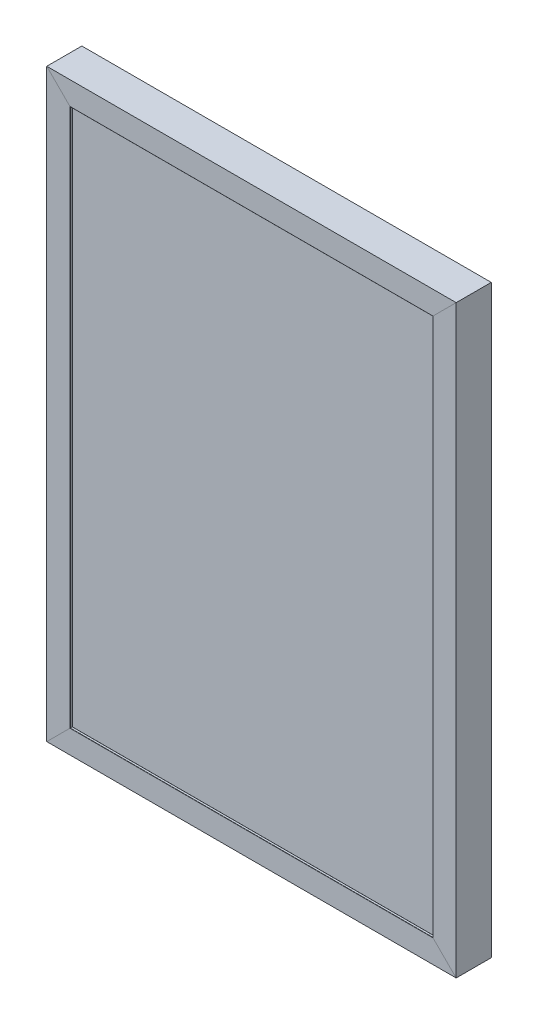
SolidWorks part; units mm, degrees
ref_plane "Vorne" through (0, 0, 0) normal (0, 0, 1) x (1, 0, 0)
ref_plane "Oben" through (0, 0, 0) normal (0, 1, 0) x (1, 0, 0)
ref_plane "Rechts" through (0, 0, 0) normal (1, 0, 0) x (0, 0, -1)
sketch "Skizze1" plane through (0, 0, 0) normal (0, 0, 1) x (1, 0, 0)
  line L0 (350, 500) -> (-350, -500) construction
  line L1 (-350, 500) -> (350, 500)
  line L2 (-350, 500) -> (-350, -500)
  line L3 (-350, -500) -> (350, -500)
  line L4 (350, 500) -> (350, -500)
  dimension "D1" = 700
  dimension "D2" = 1000
other "Strukturbauteil1"
ref_plane "Ebene1" through (-350, 500, 0) normal (0, -1, 0) x (0, 0, 1)
sketch "Sketch13" plane through (-350, 500, 0) normal (0, -1, 0) x (0, 0, -1)
  line L0 (0, 0) -> (0, 70) construction
  line L1 (-30, 0) -> (30, 0)
  line L2 (30, 0) -> (30, 39.6)
  line L3 (29.6, 40) -> (26.4, 40)
  line L4 (26, 39.6) -> (26, 6.5)
  line L5 (23.5, 4) -> (-23.5, 4)
  line L6 (-26, 39.6) -> (-26, 6.5)
  line L7 (-29.6, 40) -> (-26.4, 40)
  line L8 (-30, 0) -> (-30, 39.6)
  arc A0 (-29.6, 40) -> (-30, 39.6) centre (-29.6, 39.6) ccw
  arc A1 (-26, 39.6) -> (-26.4, 40) centre (-26.4, 39.6) ccw
  arc A2 (26.4, 40) -> (26, 39.6) centre (26.4, 39.6) ccw
  arc A3 (30, 39.6) -> (29.6, 40) centre (29.6, 39.6) ccw
  arc A4 (-26, 6.5) -> (-23.5, 4) centre (-23.5, 6.5) ccw
  arc A5 (26, 6.5) -> (23.5, 4) centre (23.5, 6.5) cw
  point P13 (-30, 40)
  point P16 (-26, 40)
  point P19 (26, 40)
  point P22 (30, 40)
  point P25 (-26, 4)
  point P28 (26, 4)
  point P29 (0, 0)
  dimension "R1" = 0.4
  dimension "R2" = 2.5
  dimension "h" = 60
  dimension "b" = 40
  dimension "t" = 4
  dimension "s" = 4
sketch "Skizze16" plane through (0, 0, 0) normal (0, 1, 0) x (1, 0, 0)
  line L0 (0, -16) -> (0, 16)
  dimension "D1" = 32
other "Strukturbauteil2"
ref_plane "Ebene3" through (0, 0, 16) normal (0, 0, -1) x (0, 1, 0)
sketch "Skizze17" plane through (0, 0, 16) normal (0, 0, -1) x (0, 1, 0)
  line L0 (-495, -345) -> (495, -345)
  line L1 (-495, -345) -> (-495, 345)
  line L2 (495, -345) -> (495, 345)
  line L3 (-495, 345) -> (495, 345)
  line L4 (0, -345) -> (0, 345) construction
  line L5 (500, -350) -> (-500, -350) construction
  line L6 (500, -350) -> (500, 350) construction
  point P6 (-495, 0)
  point P7 (495, 0)
  point P8 (0, 0)
  dimension "D1" = 5
  dimension "D2" = 5
  dimension "D3" = 690
  dimension "D4" = 990
